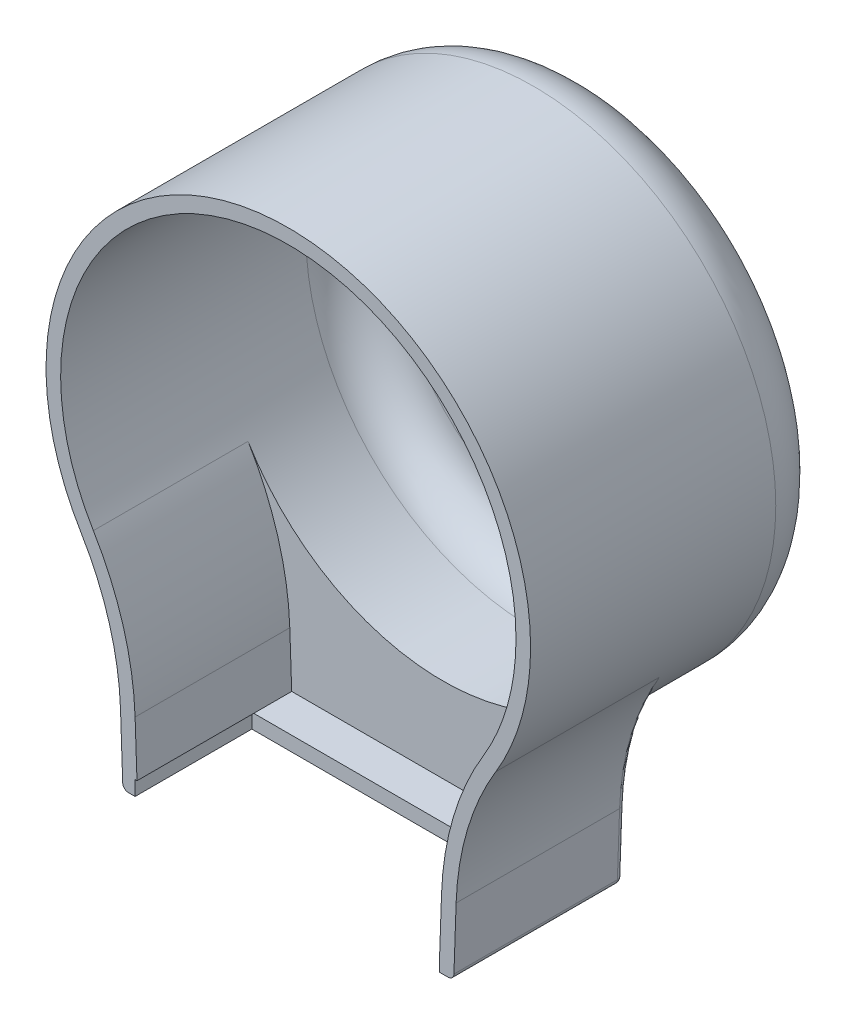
SolidWorks part; units mm, degrees
ref_plane "Face" through (0, 0, 0) normal (0, 0, 1) x (1, 0, 0)
ref_plane "Dessus" through (0, 0, 0) normal (0, 1, 0) x (1, 0, 0)
ref_plane "Droite" through (0, 0, 0) normal (1, 0, 0) x (0, 0, -1)
sketch "Esquisse1" plane through (0, 0, 4) normal (0, 0, 1) x (1, 0, 0)
  line L2 (-28.3347, -56) -> (28.3347, -56)
  line L4 (-28.7432, -44.3029) -> (-20.4875, -280.7154)
  line L5 (20.4875, -280.7154) -> (28.7432, -44.3029)
  line L6 (-28.7432, -44.3029) -> (-28.3347, -56)
  line L7 (28.3347, -56) -> (28.7432, -44.3029)
  arc A8 (-28.7432, -44.3029) -> (-35.5381, -21.4311) centre (-76.2143, -45.9607) ccw
  arc A9 (35.5381, -21.4311) -> (-35.5381, -21.4311) centre (0, 0) ccw
  arc A10 (35.5381, -21.4311) -> (28.7432, -44.3029) centre (76.2143, -45.9607) ccw
  arc A11 (-28.7432, -44.3029) -> (-35.5381, -21.4311) centre (-76.2143, -45.9607) ccw
  arc A12 (35.5381, -21.4311) -> (-35.5381, -21.4311) centre (0, 0) ccw
  arc A13 (35.5381, -21.4311) -> (28.7432, -44.3029) centre (76.2143, -45.9607) ccw
  dimension "D2" = 97.5
  dimension "D1" = 2.5
extrude "Base-Extrusion" add sketch "Esquisse1" against normal blind 52
sketch "Esquisse2" plane through (0, 0, -48) normal (0, 0, -1) x (-1, 0, 0)
  line L3 (-28.3347, -56) -> (-28.7432, -44.3029) construction
  line L4 (28.3347, -56) -> (-28.3347, -56) construction
  line L5 (28.7432, -44.3029) -> (28.3347, -56) construction
  line L6 (-28.3347, -56) -> (-28.7432, -44.3029)
  line L7 (28.3347, -56) -> (-28.3347, -56)
  line L8 (28.7432, -44.3029) -> (28.3347, -56)
  arc A0 (-35.5381, -21.4311) -> (35.5381, -21.4311) centre (0, 0) ccw
  arc A1 (35.5381, -21.4311) -> (-35.5381, -21.4311) centre (0, 0) ccw construction
  arc A4 (-28.7432, -44.3029) -> (-35.5381, -21.4311) centre (-76.2143, -45.9607) ccw construction
  arc A5 (35.5381, -21.4311) -> (28.7432, -44.3029) centre (76.2143, -45.9607) ccw construction
  arc A6 (-28.7432, -44.3029) -> (-35.5381, -21.4311) centre (-76.2143, -45.9607) ccw
  arc A7 (35.5381, -21.4311) -> (28.7432, -44.3029) centre (76.2143, -45.9607) ccw
extrude "Enlèv. mat.-Extru.1" cut sketch "Esquisse2" against normal blind 23
fillet "Congé1" radius 10 1 edges at (41.5, 0, -48)
shell "Coque1" thickness 2.5
sketch "Esquisse3" plane through (0, -53.5, 0) normal (0, 1, 0) x (-1, 0, 0)
  line L0 (-25.9205, -22.5) -> (-25.9205, 4) construction
  line L1 (26.2447, 4) -> (-25.9205, 4)
  line L2 (26.2447, 4) -> (26.2447, -16)
  line L3 (26.2447, -16) -> (-25.9205, -16)
  line L4 (-25.9205, 4) -> (-25.9205, -16)
  dimension "D1" = 20
extrude "Enlèv. mat.-Extru.3" cut sketch "Esquisse3" against normal through all
fillet "Congé2" radius 1 7 edges at (-28.3347, -56, -10.5) (28.3347, -56, -10.5) (30.6812, -32.4334, -25) (-30.6812, -32.4334, -25) (-28.539, -50.1515, -25) (0, -56, -25) (28.539, -50.1515, -25)
